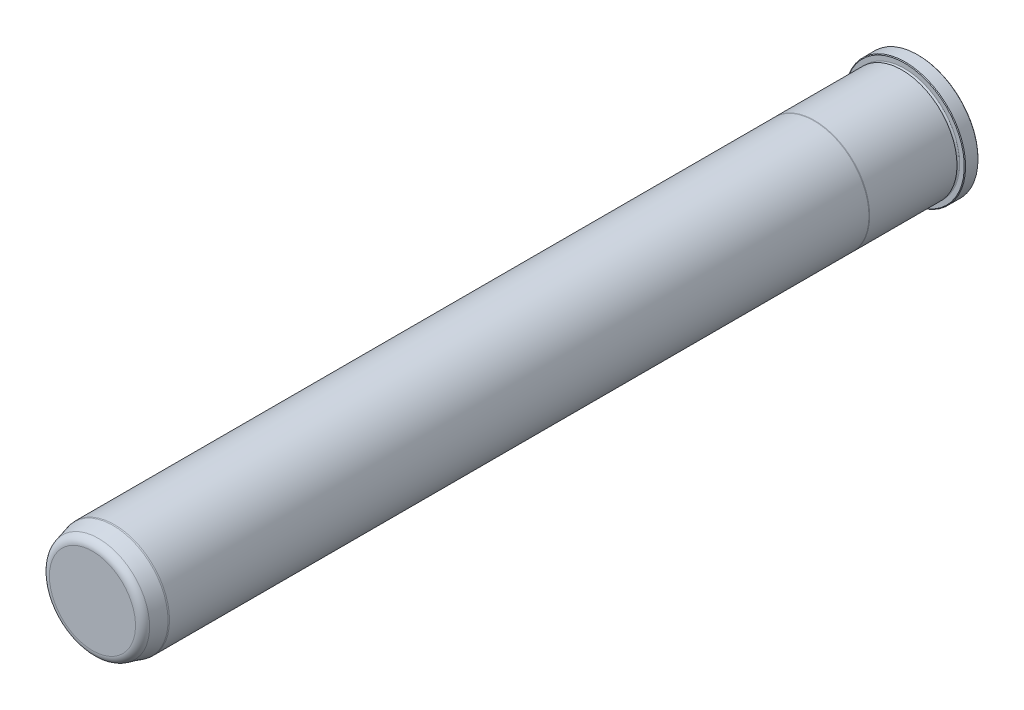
SolidWorks part; units mm, degrees
ref_plane "Front Plane" through (0, 0, 0) normal (0, 0, 1) x (1, 0, 0)
ref_plane "Top Plane" through (0, 0, 0) normal (0, 1, 0) x (1, 0, 0)
ref_plane "Right Plane" through (0, 0, 0) normal (1, 0, 0) x (0, 0, -1)
sketch "Sketch1" plane through (0, 0, 0) normal (1, 0, 0) x (0, 0, -1)
  line L0 (0, 0) -> (0, 34.798)
  line L1 (0, 34.798) -> (-7.9248, 34.798)
  line L2 (-7.9248, 34.798) -> (-7.9248, 31.7373)
  line L3 (-7.9248, 30.9753) -> (-9.4488, 30.9753) construction
  line L4 (-9.4488, 31.7373) -> (-9.4488, 31.7627)
  line L5 (-9.4488, 31.7627) -> (-59.8348, 31.7627)
  line L6 (-59.8348, 31.7627) -> (-60.198, 31.7373)
  line L7 (-60.198, 31.7373) -> (-463.55, 31.7373)
  line L9 (-476.25, 28.4719) -> (-476.25, 0)
  line L10 (-476.25, 0) -> (0, 0)
  line L11 (0, 0) -> (13.6287, 0) construction
  line L12 (-463.55, 31.7373) -> (-464.312, 31.6706)
  line L13 (-464.312, 31.6706) -> (-476.25, 28.4719)
  arc A0 (-9.4488, 31.7373) -> (-7.9248, 31.7373) centre (-8.6868, 31.7373) ccw
  dimension "D14" = 1.524
  dimension "D1" = 7.9248
  dimension "D2" = 1.524
  dimension "D3" = 69.596
  dimension "D4" = 63.5254
  dimension "D5" = 60.198
  dimension "D6" = 476.25
  dimension "D7" = 0.7874
  dimension "D8" = 4
  dimension "D9" = 63.4746
  dimension "D10" = 5
  dimension "D11" = 15
  dimension "D12" = 0.762
  dimension "D13" = 12.7
revolve "Revolve1" add sketch "Sketch1" angle 360 about L11
fillet "Fillet6" radius 4.7625 1 edges at (28.4719, 0, 476.25)
chamfer "Chamfer1" distance 0.381 angle 45 2 edges at (34.798, 0, 0) (34.798, 0, 7.9248)
